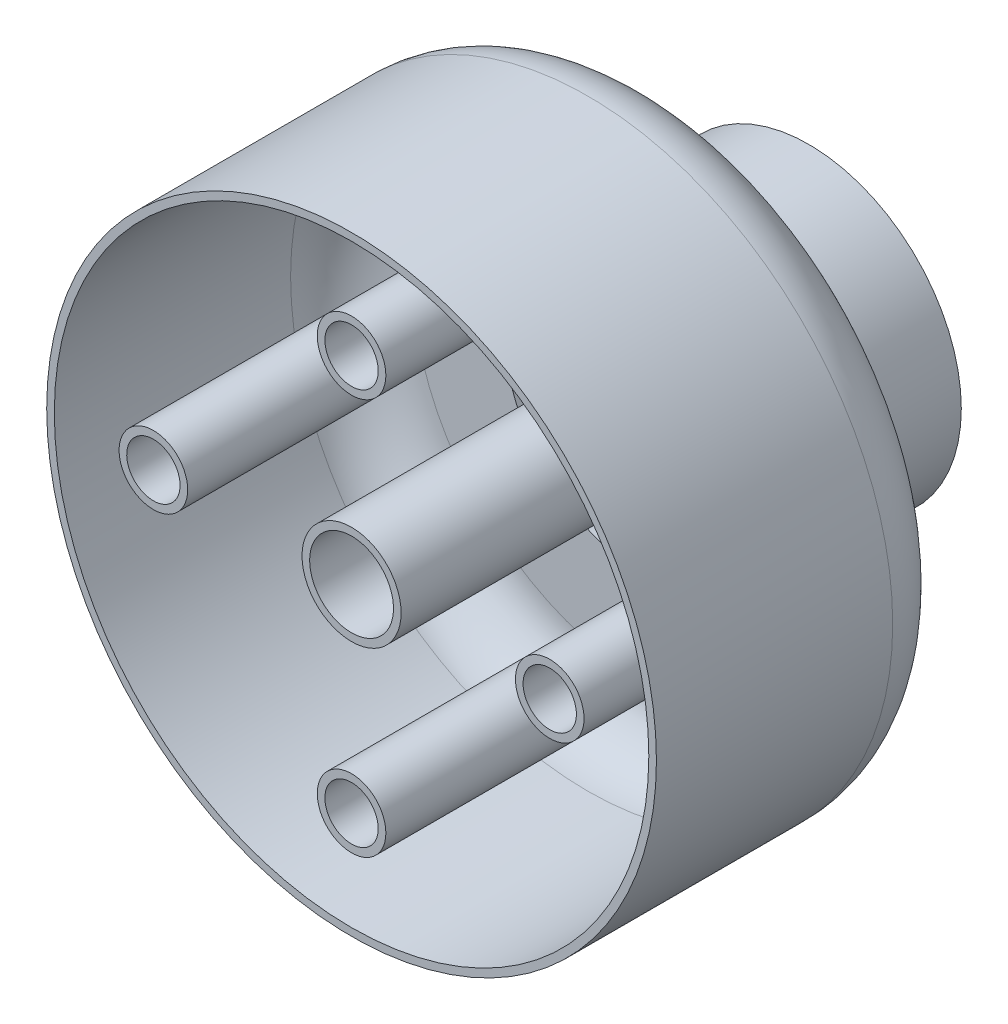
SolidWorks part; units mm, degrees
ref_plane "Front Plane" through (0, 0, 0) normal (0, 0, 1) x (1, 0, 0)
ref_plane "Top Plane" through (0, 0, 0) normal (0, 1, 0) x (1, 0, 0)
ref_plane "Right Plane" through (0, 0, 0) normal (1, 0, 0) x (0, 0, -1)
sketch "Sketch1" plane through (0, 0, 0) normal (0, 0, 1) x (1, 0, 0)
  circle A0 centre (0, 0) radius 5
  dimension "D1" = 10
extrude "Boss-Extrude1" add sketch "Sketch1" along normal blind 5
sketch "Sketch2" plane through (0, 0, 5) normal (0, 0, 1) x (1, 0, 0)
  circle A0 centre (0, 0) radius 10
  dimension "D1" = 20
extrude "Boss-Extrude2" add sketch "Sketch2" along normal blind 10
sketch "Sketch3" plane through (0, 0, 0) normal (0, 0, -1) x (-1, 0, 0)
  circle A0 centre (0, 0) radius 4.75
  dimension "D1" = 9.5
extrude "Cut-Extrude1" cut sketch "Sketch3" against normal blind 1
sketch "Sketch4" plane through (0, 0, 1) normal (0, 0, -1) x (-1, 0, 0)
  circle A0 centre (0, 0) radius 1.875
  dimension "D1" = 3.75
extrude "Boss-Extrude3" add sketch "Sketch4" along normal blind 0.25
sketch "Sketch5" plane through (0, 0, 0.75) normal (0, 0, -1) x (-1, 0, 0)
  circle A0 centre (0, 0) radius 1.375
  dimension "D1" = 2.75
extrude "Cut-Extrude2" cut sketch "Sketch5" against normal through all
other "Hole1"
sketch "Sketch8" plane through (0, 0, 15) normal (0, 0, 1) x (1, 0, 0)
  circle A0 centre (0, 6.5) radius 0.875
  dimension "D1" = 1.75
  dimension "D2" = 6.5
pattern_circular "CirPattern1" count 4 over 360 about axis through (0, 0, 0) along (0, 0, 1) of "Hole1"
fillet "Fillet1" radius 2.25 1 edges at (10, 0, 5)
shell "Shell1" thickness 0.25
